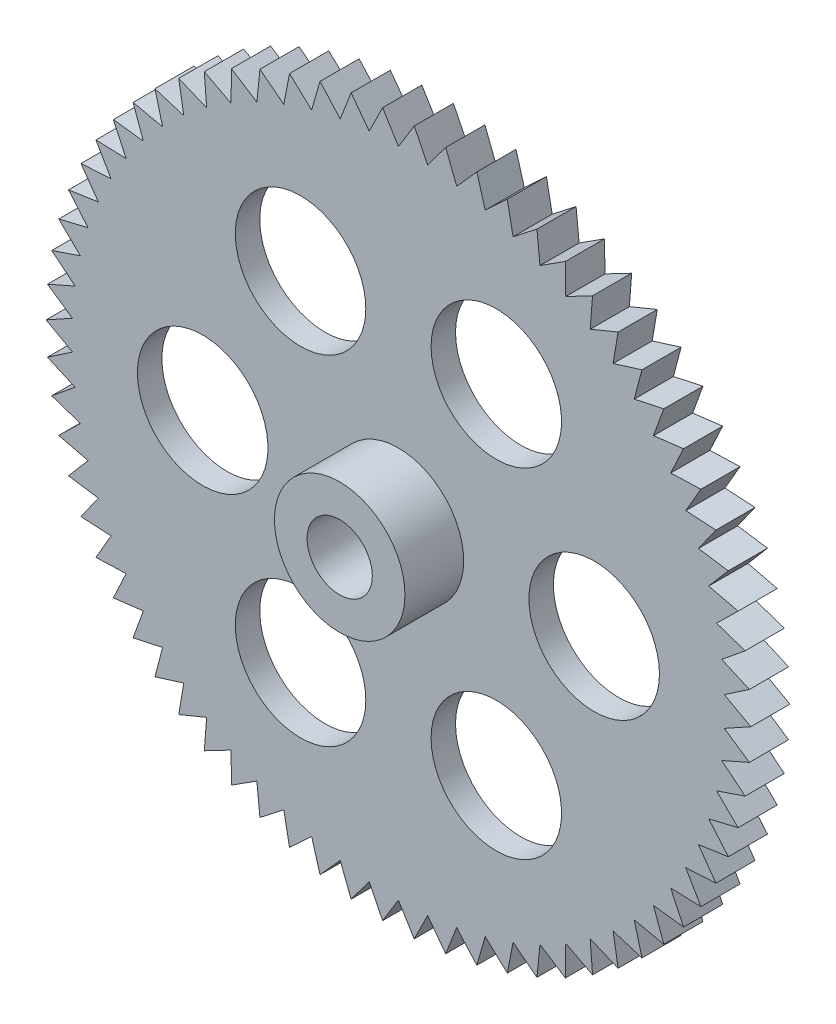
SolidWorks part; units mm, degrees
ref_plane "Face" through (0, 0, 0) normal (0, 0, 1) x (1, 0, 0)
ref_plane "Dessus" through (0, 0, 0) normal (0, 1, 0) x (1, 0, 0)
ref_plane "Droite" through (0, 0, 0) normal (1, 0, 0) x (0, 0, -1)
sketch "Esquisse1" plane through (0, 0, 0) normal (1, 0, 0) x (0, 0, -1)
  line L0 (0, 1) -> (0, 2)
  line L1 (0, 2) -> (1.8, 2)
  line L2 (1.8, 2) -> (1.8, 10.8)
  line L3 (1.8, 10.8) -> (3, 10.8)
  line L4 (3, 10.8) -> (3, 9)
  line L5 (3, 9) -> (2.55, 9)
  line L6 (2.55, 9) -> (2.55, 2)
  line L7 (2.55, 2) -> (3.55, 2)
  line L8 (3.55, 2) -> (3.55, 1)
  line L11 (3.55, 1) -> (0, 1)
  line L12 (0, 0) -> (5.45, 0) construction
  dimension "D1" = 1
  dimension "D2" = 1
  dimension "D4" = 0.45
  dimension "D5" = 1.2
  dimension "D6" = 9
  dimension "D8" = 2
  dimension "D9" = 10.8
  dimension "D10" = 1.8
revolve "Révolution1" add sketch "Esquisse1" angle 360 about L12
sketch "Esquisse2" plane through (0, 0, -1.8) normal (0, 0, 1) x (1, 0, 0)
  line L0 (0, 0) -> (6, 0) construction
  circle A0 centre (6, 0) radius 2
  dimension "D1" = 4
  dimension "D2" = 6
extrude "Extrusion1" cut sketch "Esquisse2" against normal through all
pattern_circular "Répétition circulaire1" count 6 over 360 about axis through (0, 0, 0) along (0, 0, 1) of "Extrusion1"
sketch "Esquisse3" plane through (0, 0, -1.8) normal (0, 0, 1) x (1, 0, 0)
  line L0 (0, 0) -> (10.8, 0) construction
  line L1 (10.8, 0) -> (0, 0) construction
  line L2 (0, 0) -> (10.7565, 0.9681) construction
  line L3 (0, 0) -> (9.9899, 0.4486) construction
  line L4 (10.8, 0) -> (9.9899, 0.4486)
  line L5 (9.9899, 0.4486) -> (10.7565, 0.9681)
  circle A0 centre (0, 0) radius 10.5 construction
  circle A1 centre (0, 0) radius 10 construction
  circle A3 centre (0, 0) radius 10.8 construction
  arc A4 (10.8, 0) -> (10.7565, 0.9681) centre (0, 0) ccw
  dimension "D2" = 20
  dimension "D4" = 21
  dimension "D1" = 5.143
  dimension "D3" = 2.571
extrude "Extrusion2" cut sketch "Esquisse3" against normal through all contours L5 L4 M8
pattern_circular "Répétition circulaire2" count 70 over 360 about axis through (0, 0, 0) along (0, 0, 1) of "Extrusion2"
